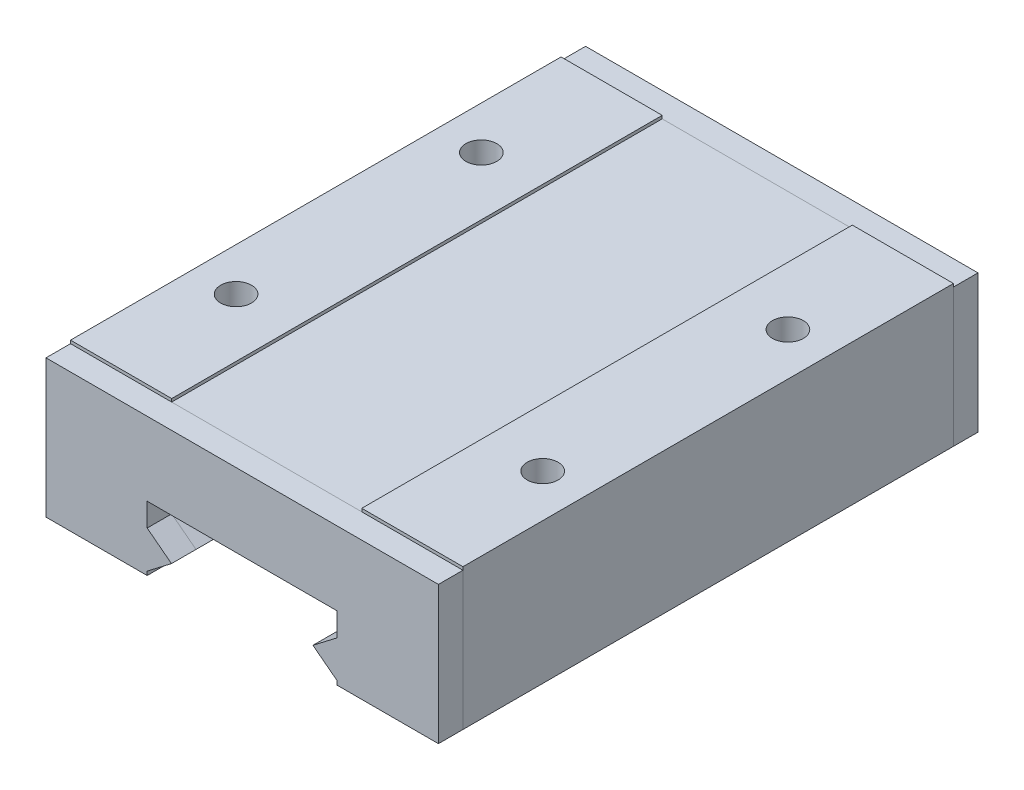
SolidWorks part; units mm, degrees
ref_plane "Front Plane" through (0, 0, 0) normal (0, 0, 1) x (1, 0, 0)
ref_plane "Top Plane" through (0, 0, 0) normal (0, 1, 0) x (1, 0, 0)
ref_plane "Right Plane" through (0, 0, 0) normal (1, 0, 0) x (0, 0, -1)
sketch "Sketch3" plane through (0, 0, 0) normal (0, 0, 1) x (1, 0, 0)
  line L0 (0, -1.3402) -> (0, 9.5975) construction
  line L1 (-16, 16) -> (-7.75, 16)
  line L2 (-16, 16) -> (-16, 4.5)
  line L3 (-16, 4.5) -> (-7.75, 4.5)
  line L4 (16, 16) -> (16, 4.5)
  line L5 (-7.5452, 6.3333) -> (3.7641, 6.3333) construction
  line L7 (-7.5, 0) -> (7.5, 0) construction
  line L8 (-7.75, 4.5) -> (-7.75, 4.8123)
  line L9 (-5.7678, 6.3333) -> (-7.75, 4.8123)
  line L10 (-7.5, 9.5) -> (7.5, 9.5) construction
  line L11 (7.5, 7.9776) -> (5.3571, 6.3333) construction
  line L12 (7.5, 7.9776) -> (7.5, 9.5) construction
  line L13 (-7.75, 7.8543) -> (-5.7678, 6.3333)
  line L14 (-7.75, 7.8543) -> (-7.75, 9.75)
  line L15 (-7.75, 9.75) -> (7.75, 9.75)
  line L16 (7.75, 7.8543) -> (7.75, 9.75)
  line L17 (7.75, 7.8543) -> (5.7678, 6.3333)
  line L18 (-7.5, 7.9776) -> (-7.5, 9.5) construction
  line L19 (-7.5, 7.9776) -> (-5.3571, 6.3333) construction
  line L20 (-5.3571, 6.3333) -> (-7.5, 4.6891) construction
  line L21 (-7.5, 0) -> (-7.5, 4.6891) construction
  line L22 (7.5, 0) -> (7.5, 4.6891) construction
  line L23 (5.7678, 6.3333) -> (7.75, 4.8123)
  line L24 (5.3571, 6.3333) -> (7.5, 4.6891) construction
  line L25 (7.75, 4.5) -> (7.75, 4.8123)
  line L39 (7.75, 4.5) -> (16, 4.5)
  line L41 (7.75, 16) -> (16, 16)
  line L43 (-7.75, 16) -> (-7.75, 15.75)
  line L44 (-7.75, 15.75) -> (7.75, 15.75)
  line L45 (7.75, 16) -> (7.75, 15.75)
extrude "Carriage" add sketch "Sketch3" along normal mid plane 40
sketch "Sketch4" plane through (0, 0, 20) normal (0, 0, 1) x (1, 0, 0)
  line L0 (-16, 15.75) -> (16, 15.75)
  line L2 (7.75, 15.75) -> (-7.75, 15.75) construction
  line L19 (-16, 16) -> (-16, 4.5)
  line L20 (-16, 4.5) -> (-7.75, 4.5)
  line L21 (-7.75, 4.5) -> (-7.75, 4.8123)
  line L22 (-7.75, 4.8123) -> (-5.7678, 6.3333)
  line L23 (-5.7678, 6.3333) -> (-7.75, 7.8543)
  line L24 (-7.75, 7.8543) -> (-7.75, 9.75)
  line L25 (-7.75, 9.75) -> (7.75, 9.75)
  line L26 (7.75, 9.75) -> (7.75, 7.8543)
  line L27 (7.75, 7.8543) -> (5.7678, 6.3333)
  line L28 (5.7678, 6.3333) -> (7.75, 4.8123)
  line L29 (7.75, 4.8123) -> (7.75, 4.5)
  line L30 (7.75, 4.5) -> (16, 4.5)
  line L31 (16, 4.5) -> (16, 16)
  line L32 (16, 16) -> (7.75, 16)
  line L33 (7.75, 16) -> (7.75, 15.75)
  line L34 (7.75, 15.75) -> (-7.75, 15.75)
  line L35 (-7.75, 15.75) -> (-7.75, 16)
  line L36 (-7.75, 16) -> (-16, 16)
  line L37 (-16, 15.75) -> (-16, 4.5)
  line L38 (-16, 4.5) -> (-7.75, 4.5)
  line L39 (-7.75, 4.5) -> (-7.75, 4.8123)
  line L40 (-7.75, 4.8123) -> (-5.7678, 6.3333)
  line L41 (-5.7678, 6.3333) -> (-7.75, 7.8543)
  line L42 (-7.75, 7.8543) -> (-7.75, 9.75)
  line L43 (-7.75, 9.75) -> (7.75, 9.75)
  line L44 (7.75, 9.75) -> (7.75, 7.8543)
  line L45 (7.75, 7.8543) -> (5.7678, 6.3333)
  line L46 (5.7678, 6.3333) -> (7.75, 4.8123)
  line L47 (7.75, 4.8123) -> (7.75, 4.5)
  line L48 (7.75, 4.5) -> (16, 4.5)
  line L49 (16, 4.5) -> (16, 15.75)
  dimension "D1" = 0
extrude "Side-seal1" add sketch "Sketch4" along normal blind 2 separate body
ref_plane "Plane2" through (0, 0, -22) normal (0, 0, 1) x (1, 0, 0)
sketch "Sketch5" plane through (0, 0, -22) normal (0, 0, 1) x (1, 0, 0)
  line L8 (-16, 4.5) -> (-7.75, 4.5)
  line L9 (-16, 4.5) -> (-7.75, 4.5)
  line L10 (-7.75, 4.5) -> (-7.75, 4.8123)
  line L11 (-7.75, 4.5) -> (-7.75, 4.8123)
  line L12 (-7.75, 4.8123) -> (-5.7678, 6.3333)
  line L13 (-7.75, 4.8123) -> (-5.7678, 6.3333)
  line L14 (-5.7678, 6.3333) -> (-7.75, 7.8543)
  line L15 (-5.7678, 6.3333) -> (-7.75, 7.8543)
  line L16 (-7.75, 7.8543) -> (-7.75, 9.75)
  line L17 (-7.75, 7.8543) -> (-7.75, 9.75)
  line L18 (-7.75, 9.75) -> (7.75, 9.75)
  line L19 (-7.75, 9.75) -> (7.75, 9.75)
  line L20 (7.75, 9.75) -> (7.75, 7.8543)
  line L21 (7.75, 9.75) -> (7.75, 7.8543)
  line L22 (7.75, 7.8543) -> (5.7678, 6.3333)
  line L23 (7.75, 7.8543) -> (5.7678, 6.3333)
  line L30 (5.7678, 6.3333) -> (7.75, 4.8123)
  line L31 (5.7678, 6.3333) -> (7.75, 4.8123)
  line L32 (7.75, 4.8123) -> (7.75, 4.5)
  line L33 (7.75, 4.8123) -> (7.75, 4.5)
  line L34 (7.75, 4.5) -> (16, 4.5)
  line L35 (7.75, 4.5) -> (16, 4.5)
  line L36 (16, 4.5) -> (16, 15.75)
  line L37 (16, 4.5) -> (16, 15.75)
  line L38 (16, 15.75) -> (-16, 15.75)
  line L39 (16, 15.75) -> (-16, 15.75)
  line L40 (-16, 15.75) -> (-16, 4.5)
  line L41 (-16, 15.75) -> (-16, 4.5)
  dimension "D1" = 0
extrude "Side-seal2" add sketch "Sketch5" along normal up to surface (2 mm away) separate body
sketch "Sketch11" plane through (0, 16, 0) normal (0, 1, 0) x (-1, 0, 0)
  line L0 (-15.0071, 0) -> (14.8228, 0) construction
  line L2 (-7.75, 20) -> (7.75, 20) construction
  line L4 (0, 20.6756) -> (0, -23.794) construction
  line L5 (-16, 20) -> (-16, -20) construction
  line L6 (16, 20) -> (16, -20) construction
  line L7 (-7.75, -20) -> (7.75, -20) construction
  circle A0 centre (-12.5, 10) radius 1.26
  circle A1 centre (12.5, 10) radius 1.26
  circle A2 centre (12.5, -10) radius 1.26
  circle A3 centre (-12.5, -10) radius 1.26
extrude "Hole" cut sketch "Sketch11" against normal blind 4
equation "\"D1@Side-seal1\"=(\"Length [L2]@Plane2\"-\"Length [L1]@Carriage\")/2"
equation "\"D3@Sketch3\" = \"Height [H1]@Sketch3\"/3"
equation "\"D5@Sketch3\"=\"Width [C]@Sketch3\"/7"
equation "\"D2@Cosmetic Thread6\" = \"Thread [S1]@Sketch11\"+.5"
equation "\"D2@Cosmetic Thread7\" = \"Thread [S1]@Sketch11\"+.5"
equation "\"D2@Cosmetic Thread8\" = \"Thread [S1]@Sketch11\"+.5"
equation "\"D2@Cosmetic Thread9\" = \"Thread [S1]@Sketch11\"+.5"
